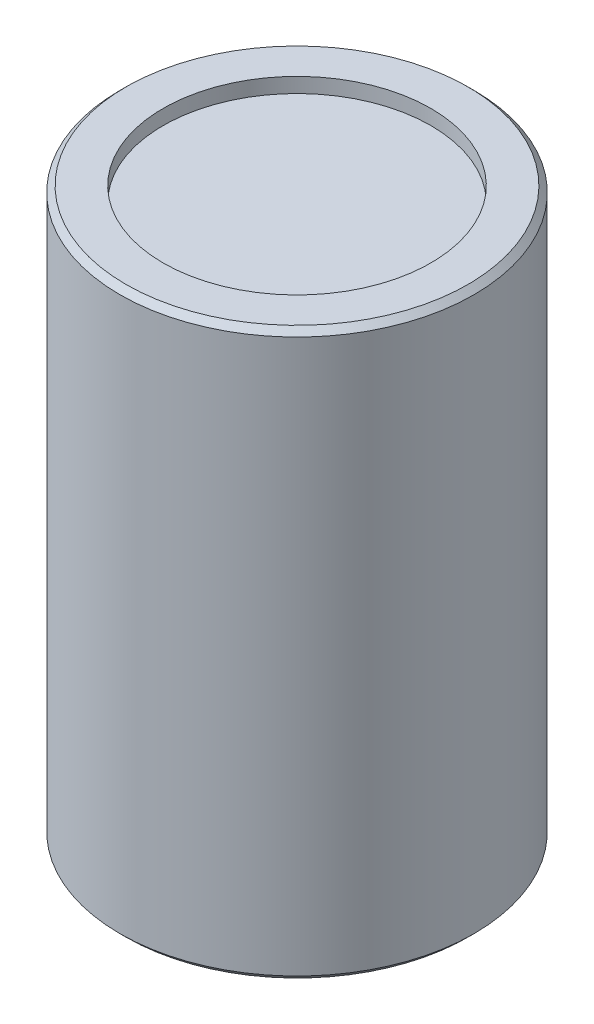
SolidWorks part; units mm, degrees
ref_plane "Ön Düzlem" through (0, 0, 0) normal (0, 0, 1) x (1, 0, 0)
ref_plane "Üst Düzlem" through (0, 0, 0) normal (0, 1, 0) x (1, 0, 0)
ref_plane "Sağ Düzlem" through (0, 0, 0) normal (1, 0, 0) x (0, 0, -1)
sketch "Çizim1" plane through (0, 0, 0) normal (0, 1, 0) x (1, 0, 0)
  circle A0 centre (0, 0) radius 59.5
  dimension "D1" = 119
extrude "Yükseklik-Ekstrüzyon1" add sketch "Çizim1" along normal blind 190
sketch "Çizim2" plane through (0, 190, 0) normal (0, 1, 0) x (1, 0, 0)
  circle A0 centre (0, 0) radius 45
extrude "Kes-Ekstrüzyon1" cut sketch "Çizim2" against normal blind 5
chamfer "Pah1" distance 2 angle 45 1 edges at (0, 190, 59.5)
chamfer "Pah2" distance 2 angle 45 1 edges at (0, 0, 59.5)
sketch "Çizim3" plane through (0, 0, 0) normal (0, -1, 0) x (1, 0, 0)
  circle A0 centre (0, 0) radius 45
extrude "Yükseklik-Ekstrüzyon2" add sketch "Çizim3" along normal blind 6
